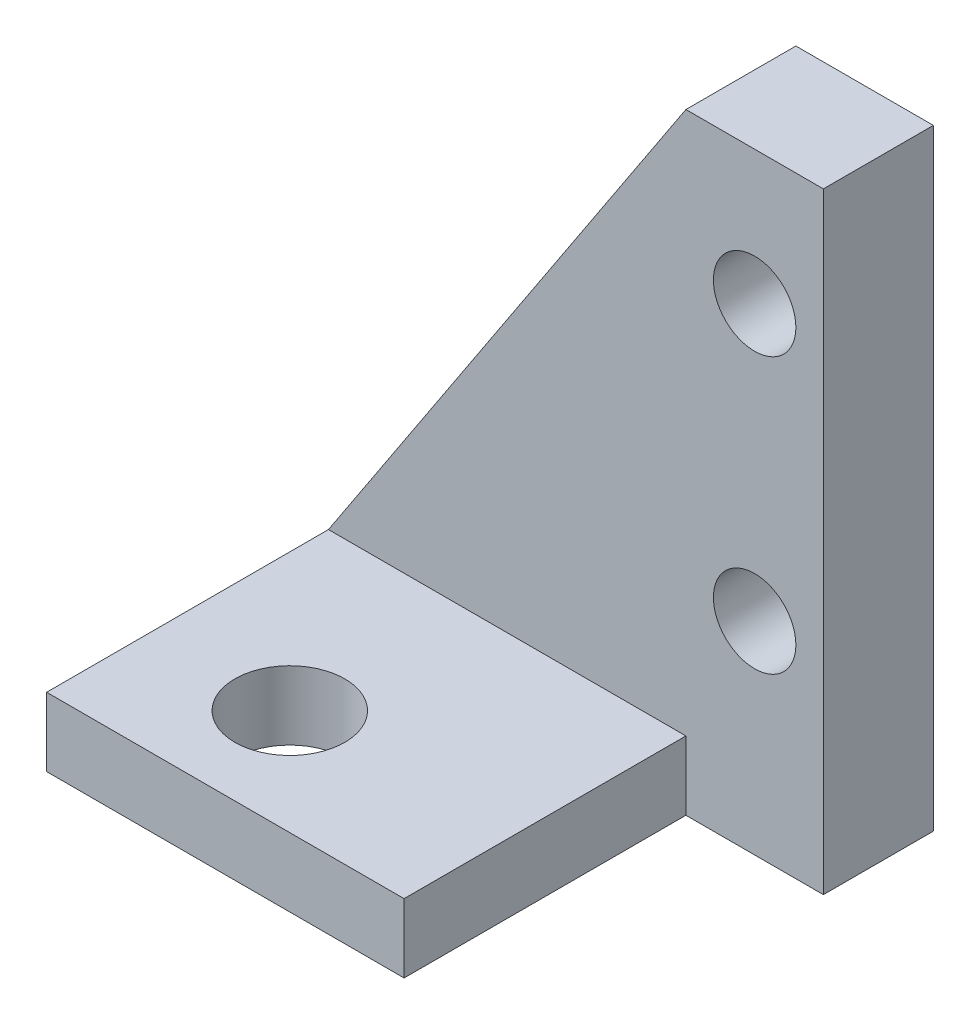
SolidWorks part; units mm, degrees
ref_plane "Front Plane" through (0, 0, 0) normal (0, 0, 1) x (1, 0, 0)
ref_plane "Top Plane" through (0, 0, 0) normal (0, 1, 0) x (1, 0, 0)
ref_plane "Right Plane" through (0, 0, 0) normal (1, 0, 0) x (0, 0, -1)
sketch "Sketch1" plane through (0, 0, 0) normal (0, 1, 0) x (1, 0, 0)
  line L1 (0, 0) -> (10, 0)
  line L2 (0, 0) -> (0, 13)
  line L3 (0, 13) -> (10, 13)
  line L4 (10, 0) -> (10, 13)
  line L5 (5, 5.8627) -> (10, 5.8627)
  line L6 (0, 4.5863) -> (0, 0)
  line L7 (0, 4.5863) -> (0, 0)
  line L8 (10, 5.8627) -> (0, 5.8627)
  circle A0 centre (5, 2.5876) radius 1.9987
extrude "Boss-Extrude1" add sketch "Sketch1" along normal blind 2.5 contours L5 L8 L2 L1 L4 A0
sketch "Sketch5" plane through (0, 0, -5.8627) normal (0, 0, -1) x (-1, 0, 0)
  line L4 (-10, 0) -> (0, 0)
  line L5 (0, 0) -> (0, 2.5)
  line L6 (0, 2.5) -> (-10, 2.5)
  line L7 (-10, 2.5) -> (-10, 0)
  line L8 (-10, 0) -> (0, 0)
  line L9 (0, 0) -> (0, 2.5)
  line L10 (0, 2.5) -> (-10, 2.5)
  line L11 (-10, 2.5) -> (-10, 0)
  dimension "D1" = 0
extrude "Boss-Extrude3" add sketch "Sketch5" along normal blind 7.13
sketch "Sketch6" plane through (0, 2.5, 0) normal (0, 1, 0) x (1, 0, 0)
  line L1 (0, 0) -> (10, 0)
  line L2 (0, 0) -> (0, -1.2567)
  line L3 (0, -1.2567) -> (10, -1.2567)
  line L4 (10, 0) -> (10, -1.2567)
extrude "Boss-Extrude4" add sketch "Sketch6" against normal blind 2.5
sketch "Sketch8" plane through (0, 2.5, 0) normal (0, 1, 0) x (1, 0, 0)
  line L1 (10, 12.9927) -> (15, 12.9927)
  line L2 (10, 12.9927) -> (10, 8.9927)
  line L3 (10, 8.9927) -> (15, 8.9927)
  line L4 (15, 12.9927) -> (15, 8.9927)
extrude "Boss-Extrude5" add sketch "Sketch8" against normal blind 2.5
sketch "Sketch9" plane through (0, 2.5, 0) normal (0, 1, 0) x (-1, 0, 0)
  line L0 (0, -12.9927) -> (-15, -12.9927) construction
  line L1 (-15, -8.9927) -> (-10, -8.9927)
  line L2 (-15, -8.9927) -> (-15, -12.9927)
  line L3 (-15, -12.9927) -> (-10, -12.9927)
  line L4 (-10, -8.9927) -> (-10, -12.9927)
extrude "Boss-Extrude6" add sketch "Sketch9" along normal blind 19.73
sketch "Sketch12" plane through (0, 0, 0) normal (0, 0, 1) x (1, 0, 0)
  circle A2 centre (12.5, 17.365) radius 1.5
  circle A3 centre (12.5, 7.365) radius 1.5
extrude "Cut-Extrude3" cut sketch "Sketch12" against normal blind 22
sketch "Sketch13" plane through (0, 2.5, 0) normal (0, 1, 0) x (1, 0, 0)
  line L1 (0, -1.2567) -> (-3, -1.2567)
  line L2 (0, -1.2567) -> (0, 12.9927)
  line L3 (0, 12.9927) -> (-3, 12.9927)
  line L4 (-3, -1.2567) -> (-3, 12.9927)
extrude "Boss-Extrude9" add sketch "Sketch13" against normal blind 2.5
sketch "Sketch14" plane through (0, 2.5, 0) normal (0, 1, 0) x (-1, 0, 0)
  circle A0 centre (-2, -2.5876) radius 2
sketch "Sketch15" plane through (0, 0, -8.9927) normal (0, 0, 1) x (1, 0, 0)
  line L0 (10, 22.23) -> (-3, 2.5)
  line L1 (-3, 2.5) -> (10, 2.5)
  line L2 (10, 2.5) -> (10, 22.23)
sketch "Sketch16" plane through (0, 2.5, 0) normal (0, 1, 0) x (1, 0, 0)
  circle A0 centre (5, 2.5876) radius 1.9987
extrude "Boss-Extrude11" add sketch "Sketch16" against normal blind 2.5
extrude "Cut-Extrude5" cut sketch "Sketch14" against normal blind 2.5
extrude "Boss-Extrude12" add sketch "Sketch15" against normal blind 4
